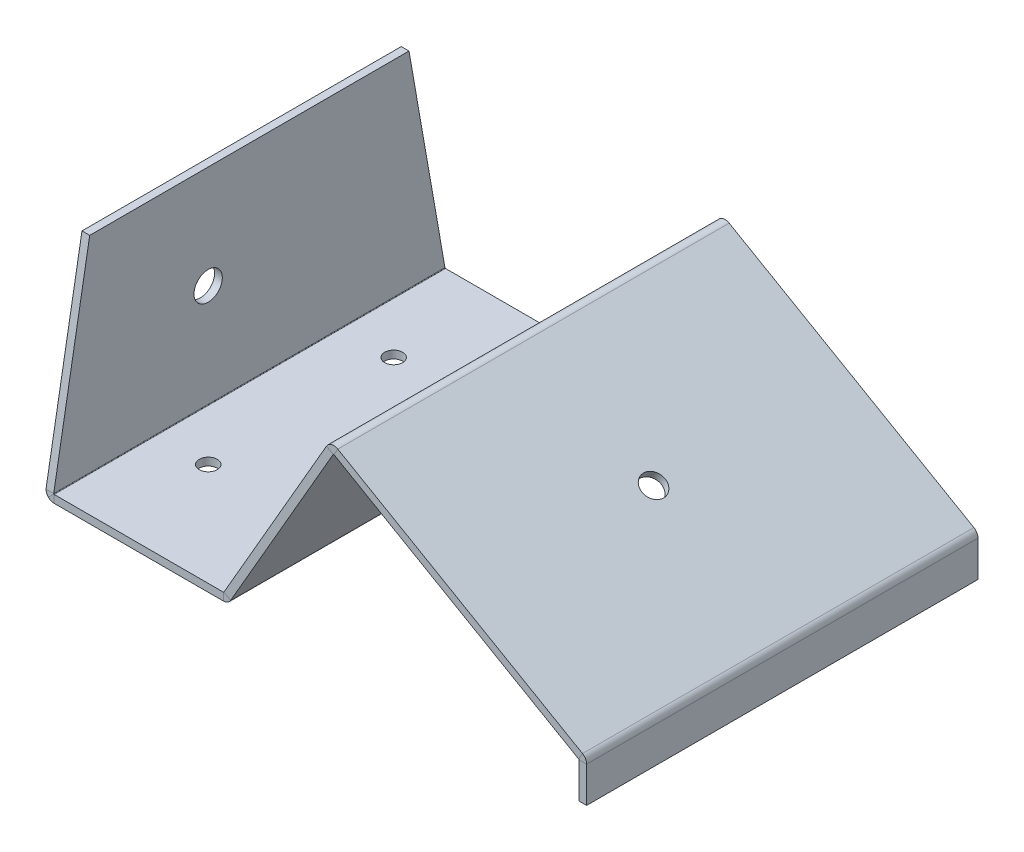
SolidWorks part; units mm, degrees
ref_plane "Front Plane" through (0, 0, 0) normal (0, 0, 1) x (1, 0, 0)
ref_plane "Top Plane" through (0, 0, 0) normal (0, 1, 0) x (1, 0, 0)
ref_plane "Right Plane" through (0, 0, 0) normal (1, 0, 0) x (0, 0, -1)
sketch "Sketch1" plane through (0, 0, 0) normal (0, 1, 0) x (1, 0, 0)
  line L0 (0, 0) -> (175, 0) construction
  line L1 (0, -31) -> (0, 31)
  line L2 (0, 31) -> (40, 38)
  line L3 (40, 38) -> (175, 38)
  line L4 (175, 38) -> (175, -38)
  line L5 (93, 18) -> (50, 18) construction
  line L6 (93, -18) -> (50, -18) construction
  line L7 (40, -38) -> (175, -38)
  line L8 (0, -31) -> (40, -38)
  circle A0 centre (50, 18) radius 1.75
  circle A1 centre (93, 18) radius 1.75
  circle A2 centre (93, -18) radius 1.75
  circle A3 centre (50, -18) radius 1.75
  circle A4 centre (140, 0) radius 2.25
  circle A5 centre (20, -8) radius 2.75
  dimension "D5" = 3.5
  dimension "D6" = 18
  dimension "D7" = 10
  dimension "D8" = 43
  dimension "D9" = 4.5
  dimension "D10" = 35
  dimension "D11" = 5.5
  dimension "D12" = 20
  dimension "D13" = 8
  dimension "D1" = 40
  dimension "D2" = 31
  dimension "D3" = 38
  dimension "D4" = 135
sheet metal parameters "Sheet-Metal1" thickness 1.5 parameters "D1"=1
base flange "Base-Flange1" sketch "Sketch1" thickness 1.5 reverse thickness direction yes parameters "D1"=1
sketch "Sketch3" plane through (0, 1.5, 0) normal (0, 1, 0) x (1, 0, 0)
  line L0 (40, -38) -> (40, 38)
sketched bend "Sketched Bend1" parameters "D1"=0.1
bend "SketchBend1" bend radius 0.1 bend angle 90 parameters "D5"=1
sketch "Sketch4" plane through (0, 1.5, 0) normal (0, 1, 0) x (1, 0, 0)
  line L0 (73, -38) -> (73, 38)
  line L1 (40.0786, -38) -> (175, -38) construction
  line L2 (175, 38) -> (40.0786, 38) construction
  line L3 (175, -38) -> (175, 38) construction
  dimension "D1" = 102
sketched bend "Sketched Bend2" parameters "D1"=0.1
bend "SketchBend2" bend radius 0.1 bend angle 60 parameters "D5"=2
sketch "Sketch5" plane through (54.1045, -31.2373, 0) normal (-0.866, 0.5, 0) x (0, 0, 1)
  line L0 (-38, 77.8071) -> (38, 77.8071)
  line L1 (-38, 139.8071) -> (-38, 37.8595) construction
  line L2 (38, 37.8595) -> (38, 139.8071) construction
  line L3 (38, 139.8071) -> (-38, 139.8071) construction
  dimension "D1" = 62
sketched bend "Sketched Bend3" parameters "D1"=0.1
bend "SketchBend3" bend radius 0.1 bend angle 90 parameters "D5"=3
sketch "Sketch6" plane through (39.6643, 68.7005, 0) normal (0.5, 0.866, 0) x (0.866, -0.5, 0)
  line L0 (118.996, 38) -> (118.996, -38)
  line L1 (125.996, 38) -> (64.0745, 38) construction
  line L2 (64.0745, -38) -> (125.996, -38) construction
  line L3 (125.996, -38) -> (125.996, 38) construction
  dimension "D1" = 7
sketched bend "Sketched Bend4" parameters "D1"=0.1
bend "SketchBend4" bend radius 0.1 bend angle 60 parameters "D5"=4
flat pattern "Flat-Pattern1"
sketch "Bend-Lines1" plane through (0, 0, 0) normal (0, 1, 0) x (-1, 0, 0)
bend of the flat pattern "Flatten-<SketchBend1>1"
bend of the flat pattern "Flatten-<SketchBend2>1"
bend of the flat pattern "Flatten-<SketchBend3>1"
bend of the flat pattern "Flatten-<SketchBend4>1"
